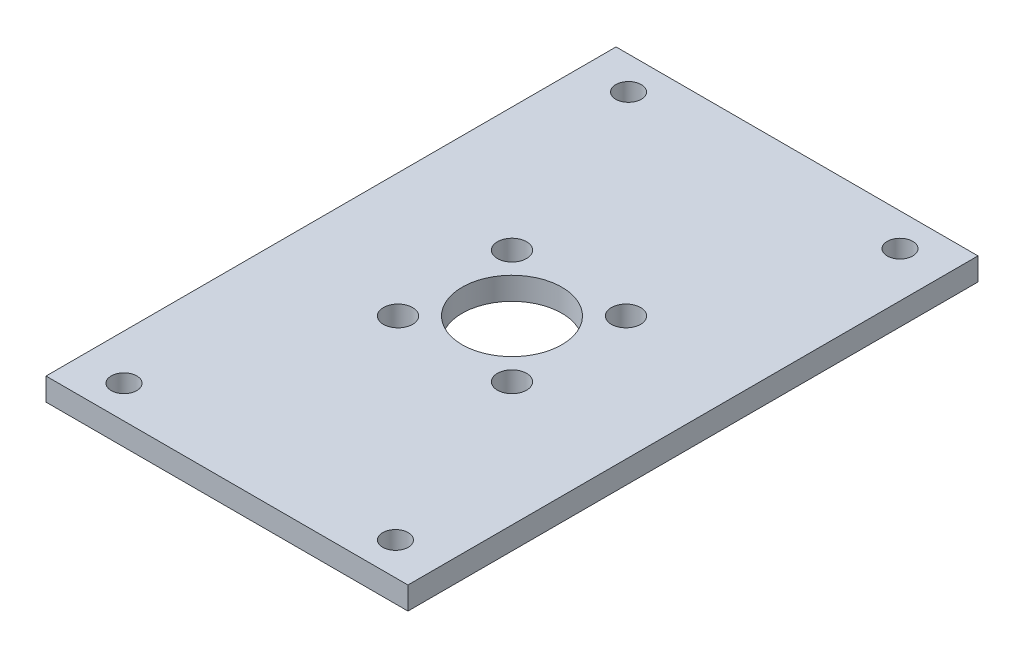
SolidWorks part; units mm, degrees
ref_plane "Front Plane" through (0, 0, 0) normal (0, 0, 1) x (1, 0, 0)
ref_plane "Top Plane" through (0, 0, 0) normal (0, 1, 0) x (1, 0, 0)
ref_plane "Right Plane" through (0, 0, 0) normal (1, 0, 0) x (0, 0, -1)
sketch "Sketch1" plane through (0, 0, 0) normal (0, 1, 0) x (1, 0, 0)
  line L6 (-25.4, 40.005) -> (-25.4, -40.005)
  line L7 (-25.4, 40.005) -> (25.4, 40.005)
  line L13 (25.4, -40.005) -> (-25.4, -40.005)
  line L18 (25.4, -40.005) -> (25.4, 40.005)
  point P0 (0, 0)
  point P1 (-25.4, 0)
  dimension "D1" = 80.01
  dimension "D2" = 50.8
extrude "Boss-Extrude1" add sketch "Sketch1" along normal blind 3.175
sketch "Sketch3" plane through (0, 0, 0) normal (0, 1, 0) x (1, 0, 0)
  line L2 (25.4, 40.005) -> (-25.4, 40.005) construction
  line L3 (-25.4, 40.005) -> (-25.4, -40.005) construction
  line L4 (25.4, -40.005) -> (25.4, 40.005) construction
  circle A0 centre (-19.05, 35.4076) radius 1.7907
  circle A1 centre (19.05, 35.4076) radius 1.7907
  dimension "D1" = 3.5814
  dimension "D2" = 6.35
  dimension "D3" = 4.5974
  dimension "D4" = 6.35
  dimension "D5" = 4.5974
extrude "Cut-Extrude7" cut sketch "Sketch3" along normal up to surface (3.175 mm away)
sketch "Sketch5" plane through (0, 0, 0) normal (0, 1, 0) x (1, 0, 0)
  circle A0 centre (0, 0) radius 7
  dimension "D1" = 14
extrude "Cut-Extrude8" cut sketch "Sketch5" along normal up to surface (3.175 mm away)
pattern_circular "CirPattern2" count 4 over 360 about axis through (0, 3.175, 0) along (0, 1, 0) of "Cut-Extrude7"
sketch "Sketch6" plane through (0, 3.175, 0) normal (0, 1, 0) x (1, 0, 0)
  line L0 (0, 0) -> (8, 8) construction
  line L1 (0, 0) -> (8, 0) construction
  circle A0 centre (8, 8) radius 2.05
  dimension "D4" = 4.1
  dimension "D1" = 8
  dimension "D2" = 8
  dimension "D3" = 45
extrude "Cut-Extrude9" cut sketch "Sketch6" against normal through all
pattern_circular "CirPattern3" count 4 over 360 about axis through (0, 0, 0) along (0, 1, 0) of "Cut-Extrude9"
